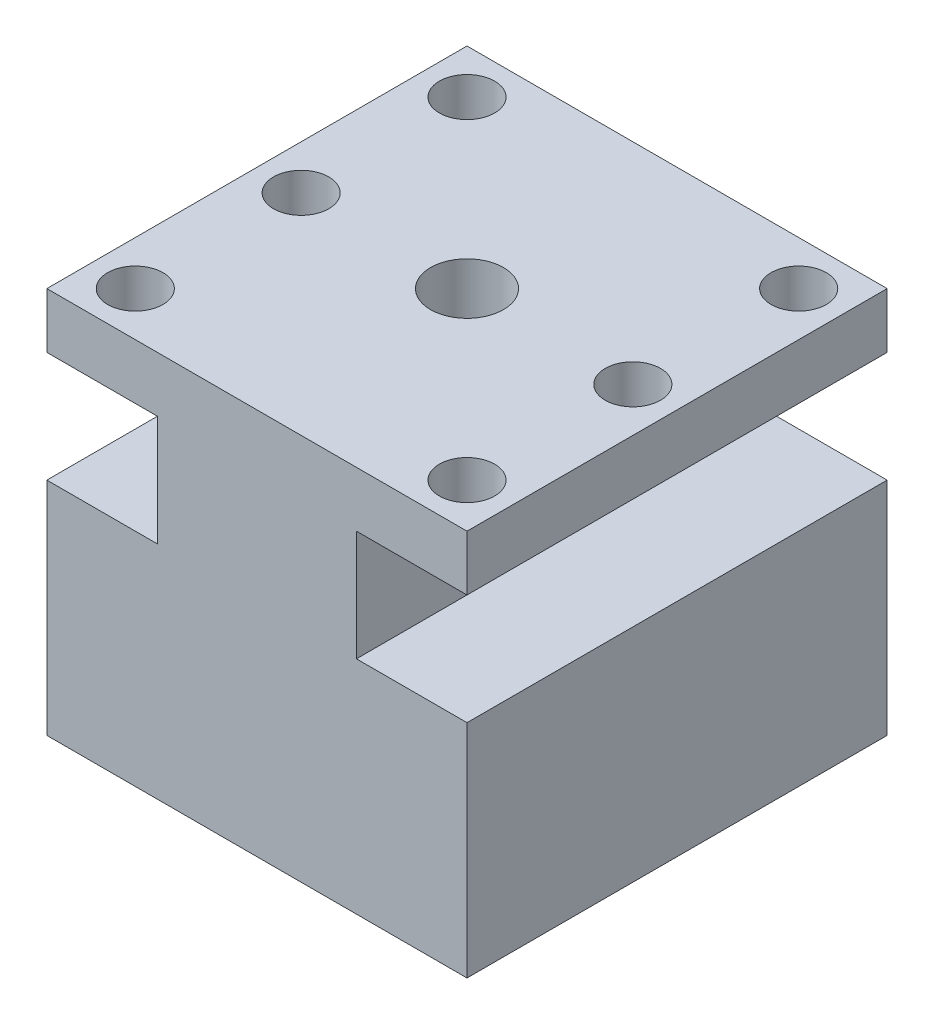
SolidWorks part; units mm, degrees
ref_plane "Piano frontale" through (0, 0, 0) normal (0, 0, 1) x (1, 0, 0)
ref_plane "Piano superiore" through (0, 0, 0) normal (0, 1, 0) x (1, 0, 0)
ref_plane "Piano destro" through (0, 0, 0) normal (1, 0, 0) x (0, 0, -1)
sketch "Schizzo1" plane through (0, 0, 0) normal (0, 1, 0) x (1, 0, 0)
  line L1 (-19, -19) -> (19, -19)
  line L2 (-19, -19) -> (-19, 19)
  line L3 (-19, 19) -> (19, 19)
  line L4 (19, -19) -> (19, 19)
  line L5 (-19, -19) -> (19, 19) construction
  line L6 (-19, 19) -> (19, -19) construction
  point P0 (0, 0)
  dimension "D1" = 38
  dimension "D2" = 38
extrude "Estrusione-Estrusione1" add sketch "Schizzo1" along normal blind 20
sketch "Schizzo2" plane through (0, 20, 0) normal (0, 1, 0) x (1, 0, 0)
  line L0 (-19, -19) -> (19, -19) construction
  line L1 (-9, 19) -> (9, 19)
  line L2 (-9, 19) -> (-9, -19)
  line L3 (-9, -19) -> (9, -19)
  line L4 (9, 19) -> (9, -19)
  line L5 (-9, 19) -> (9, -19) construction
  line L6 (-9, -19) -> (9, 19) construction
  point P0 (0, 0)
  dimension "D1" = 18
extrude "Estrusione-Estrusione2" add sketch "Schizzo2" along normal blind 10
sketch "Schizzo3" plane through (0, 30, 0) normal (0, 1, 0) x (1, 0, 0)
  line L0 (-9, -19) -> (9, -19) construction
  line L1 (-19, 19) -> (19, 19)
  line L2 (-19, 19) -> (-19, -19)
  line L3 (-19, -19) -> (19, -19)
  line L4 (19, 19) -> (19, -19)
  line L5 (-19, 19) -> (19, -19) construction
  line L6 (-19, -19) -> (19, 19) construction
  point P0 (0, 0)
  dimension "D1" = 38
extrude "Estrusione-Estrusione3" add sketch "Schizzo3" along normal blind 5
sketch "Schizzo4" plane through (0, 35, 0) normal (0, 1, 0) x (1, 0, 0)
  circle A0 centre (0, 0) radius 3
  dimension "D1" = 6
extrude "Taglio-Estrusione1" [suppressed] cut sketch "Schizzo4" against normal blind 20
sketch "Schizzo5" plane through (0, 0, 0) normal (0, -1, 0) x (-1, 0, 0)
  circle A0 centre (0, 0) radius 3.25
  dimension "D1" = 6.5
extrude "Taglio-Estrusione2" cut sketch "Schizzo5" against normal blind 15
hole_wizard "Foro filettato M6-1" positions "Schizzo8" profile "Schizzo10" tap size "M6" standard "ISO"
sketch "Schizzo8" plane through (0, 35, 0) normal (0, 1, 0) x (1, 0, 0)
  point P0 (-15, 15)
  point P2 (-15, 0)
  point P4 (-15, -15)
  point P6 (15, 15)
  point P8 (15, 0)
  point P10 (15, -15)
  point P23 (0, 0)
  point P24 (0, 0)
  point P25 (0, 0)
  point P26 (0, 0)
  point P27 (0, 0)
  point P28 (0, 0)
  point P29 (0, 0)
  dimension "D1" = 30
  dimension "D2" = 15
  dimension "D3" = 15
  dimension "D4" = 15
  dimension "D6" = 15
sketch "Schizzo10" plane through (-15, 35, -15) normal (1, 0, 0) x (0, 0, 1)
  line L0 (0, 0) -> (0, 5)
  line L1 (0, 5) -> (2.5, 5)
  line L2 (2.5, 5) -> (2.5, 0)
  line L5 (2.5, 0) -> (0, 0)
  line L11 (0, -6.35) -> (0, 107.95) construction
  dimension "Thru Tap Drill Dia." = 5
  dimension "Thru Tap Drill Depth" = 5
sketch "Schizzo11" plane through (19, 0, 0) normal (1, 0, 0) x (0, 0, -1)
  line L1 (-19, 0) -> (19, 0) construction
  line L6 (-4, 8) -> (-4, 4)
  line L7 (-4, 4) -> (-6, 4)
  line L8 (-6, 4) -> (-6, 0)
  line L9 (-4, 8) -> (-19, 8)
  line L10 (-19, 20) -> (-19, 0) construction
  line L11 (-19, 8) -> (-19, 0)
  line L12 (-19, 0) -> (-6, 0)
  line L13 (0, 11.3744) -> (0, -3.2198) construction
  line L14 (19, 0) -> (6, 0)
  line L15 (19, 8) -> (19, 0)
  line L16 (4, 8) -> (19, 8)
  line L17 (6, 4) -> (6, 0)
  line L18 (4, 4) -> (6, 4)
  line L19 (4, 8) -> (4, 4)
extrude "Taglio-Estrusione4" [suppressed] cut sketch "Schizzo11" against normal through all
hole_wizard "Foro per Vite M6-1" positions "Schizzo12" profile "Schizzo13" hole size "M6" standard "ISO"
sketch "Schizzo12" plane through (0, 35, 0) normal (0, 1, 0) x (1, 0, 0)
  point P0 (0, 0)
sketch "Schizzo13" plane through (0, 35, 0) normal (1, 0, 0) x (0, 0, 1)
  line L0 (0, 0) -> (0, 35)
  line L1 (0, 35) -> (3.3, 35)
  line L2 (3.3, 35) -> (3.3, 0)
  line L5 (3.3, 0) -> (0, 0)
  line L11 (0, -6.35) -> (0, 107.95) construction
  dimension "Thru Hole Dia." = 6.6
  dimension "Thru Hole Depth" = 35
equation "\"D1@Schizzo11\"=38/2-12/2"
